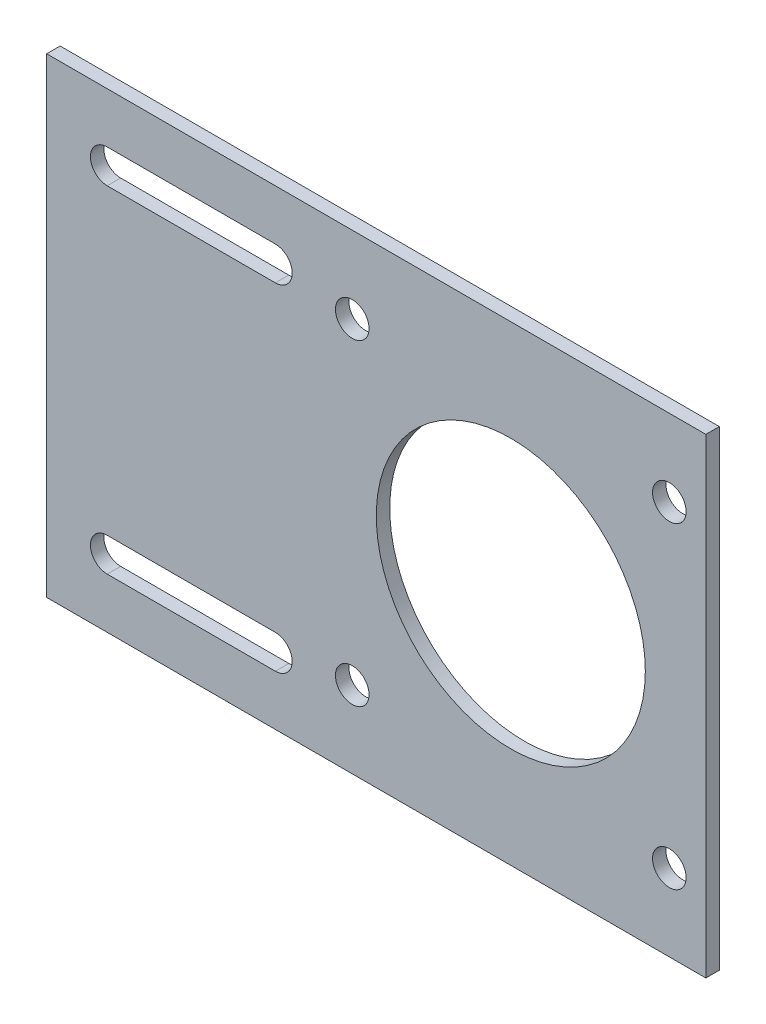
SolidWorks part; units mm, degrees
ref_plane "Alzado" through (0, 0, 0) normal (0, 0, 1) x (1, 0, 0)
ref_plane "Planta" through (0, 0, 0) normal (0, 1, 0) x (1, 0, 0)
ref_plane "Vista lateral" through (0, 0, 0) normal (1, 0, 0) x (0, 0, -1)
sketch "Croquis1" plane through (0, 0, 0) normal (0, 0, 1) x (1, 0, 0)
  line L1 (-69, 35) -> (29, 35)
  line L2 (-69, 35) -> (-69, -35)
  line L3 (-69, -35) -> (29, -35)
  line L4 (29, 35) -> (29, -35)
  line L5 (-60, 27.5) -> (-35, 27.5)
  line L6 (-60, 22.5) -> (-35, 22.5)
  line L7 (-60, -22.5) -> (-35, -22.5)
  line L8 (-60, -27.5) -> (-35, -27.5)
  circle A0 centre (0, 0) radius 20
  arc A1 (-60, -22.5) -> (-60, -27.5) centre (-60, -25) ccw
  arc A2 (-60, 27.5) -> (-60, 22.5) centre (-60, 25) ccw
  arc A3 (-35, -22.5) -> (-35, -27.5) centre (-35, -25) cw
  arc A4 (-35, 27.5) -> (-35, 22.5) centre (-35, 25) cw
extrude "Extruir1" add sketch "Croquis1" along normal blind 2
hole_wizard "Diámetro de taladro Ø5.0 (5)1" positions "Croquis3" profile "Croquis2" hole size "Ø5.0" standard "ISO"
sketch "Croquis3" plane through (0, 0, 2) normal (0, 0, 1) x (1, 0, 0)
  point P0 (23.57, 23.57)
  point P1 (-23.57, 23.57)
  point P3 (23.57, -23.57)
  point P5 (-23.57, -23.57)
sketch "Croquis2" plane through (23.57, 23.57, 2) normal (1, 0, 0) x (0, -1, 0)
  line L0 (0, 0) -> (0, 2)
  line L1 (0, 2) -> (2.5, 2)
  line L2 (2.5, 2) -> (2.5, 0)
  line L5 (2.5, 0) -> (0, 0)
  line L11 (0, -6.35) -> (0, 107.95) construction
  dimension "Diámetro de taladro hasta el siguiente" = 5
  dimension "Profundidad de taladro hasta el siguiente" = 2
